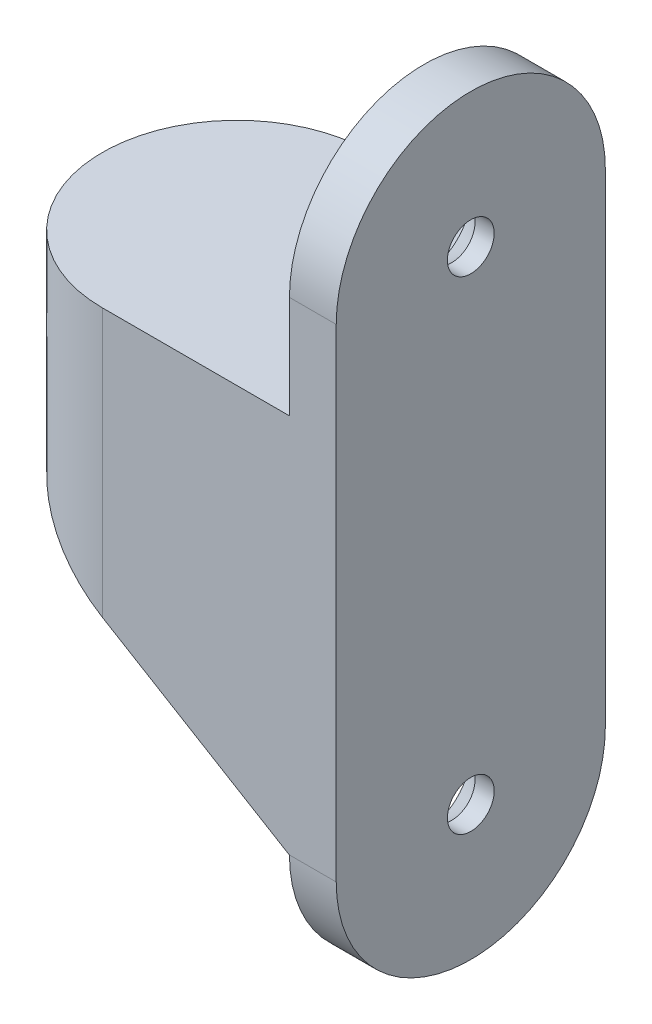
SolidWorks part; units mm, degrees
ref_plane "Front Plane" through (0, 0, 0) normal (0, 0, 1) x (1, 0, 0)
ref_plane "Top Plane" through (0, 0, 0) normal (0, 1, 0) x (1, 0, 0)
ref_plane "Right Plane" through (0, 0, 0) normal (1, 0, 0) x (0, 0, -1)
imported_body "Imported1"
hole_wizard "CSK for 1/4 Flat Head Machine Screw1" positions "Sketch1" profile "Sketch3" countersink size "1/4" standard "ANSI Inch"
sketch "Sketch1" plane through (18.2563, 0, 0) normal (-1, 0, 0) x (0, 0, 1)
  line L0 (0, -24.6438) -> (36.5252, -24.6438) construction
  point P0 (18.2626, 40.9067)
  point P3 (18.2626, -24.6438)
sketch "Sketch3" plane through (18.2563, 40.9067, 18.2626) normal (0, 1, 0) x (0, 0, 1)
  line L0 (0, 0) -> (0, 6.35)
  line L1 (0, 6.35) -> (3.175, 6.35)
  line L2 (3.175, 6.35) -> (3.175, 3.7547)
  line L3 (3.175, 3.7547) -> (6.4389, 0)
  line L5 (6.4389, 0) -> (0, 0)
  line L6 (-3.175, 3.7547) -> (-6.4389, 0) construction
  line L11 (0, -6.35) -> (0, 107.95) construction
  dimension "Thru Hole Dia." = 6.35
  dimension "Thru Hole Depth" = 6.35
  dimension "Near C'Sink Dia." = 12.8778
  dimension "Near C'Sink Angle" = 82
sketch "Sketch4" plane through (18.2563, 0, 0) normal (-1, 0, 0) x (0, 0, 1)
  line L0 (11.8237, -24.6438) -> (24.7015, -24.6438) construction
  circle A0 centre (18.2626, -24.6438) radius 6.4389
  dimension "D1" = 12.8778
extrude "Cut-Extrude1" cut sketch "Sketch4" along normal through all
